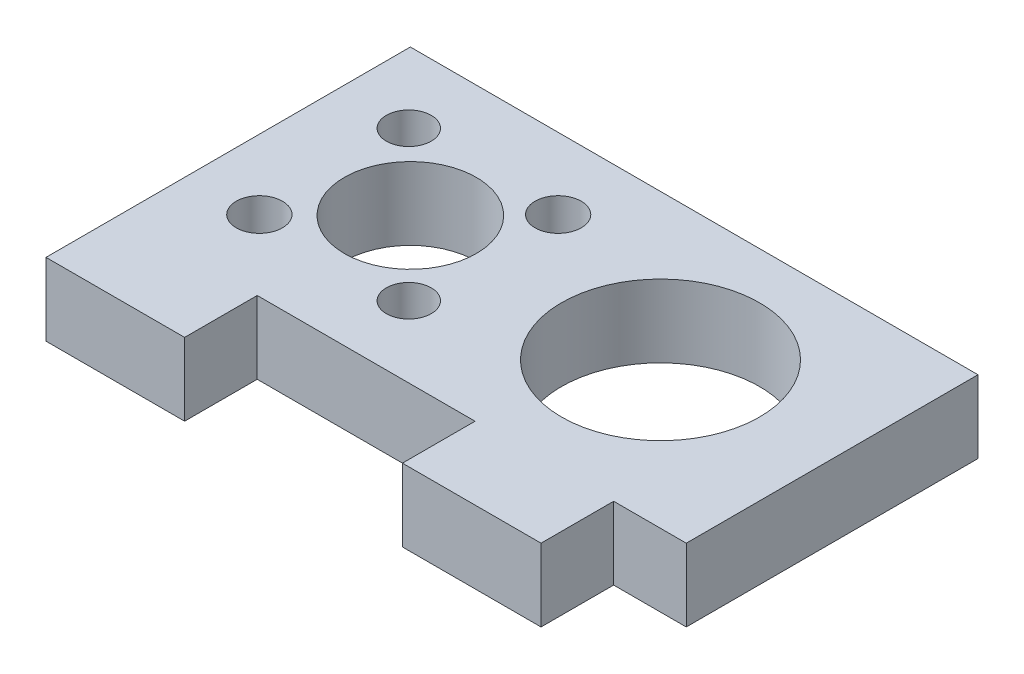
SolidWorks part; units mm, degrees
ref_plane "Front Plane" through (0, 0, 0) normal (0, 0, 1) x (1, 0, 0)
ref_plane "Top Plane" through (0, 0, 0) normal (0, 1, 0) x (1, 0, 0)
ref_plane "Right Plane" through (0, 0, 0) normal (1, 0, 0) x (0, 0, -1)
sketch "Sketch2" plane through (0, 0, 0) normal (0, 1, 0) x (1, 0, 0)
  line L0 (0, 0) -> (-37.3813, 0) construction
  line L1 (-37.3813, 0) -> (-37.3813, 5.5) construction
  line L2 (-37.3813, 5.5) -> (0, 5.5) construction
  line L4 (-37.3813, 5.5) -> (-37.3813, 27.6) construction
  line L5 (-37.3813, 27.6) -> (0.1187, 27.6) construction
  line L6 (0.1187, 27.6) -> (0.1187, 5.5) construction
  line L7 (0.1187, 5.5) -> (5.6187, 5.5) construction
  line L8 (5.6187, 5.5) -> (5.6187, 27.6) construction
  line L9 (5.6187, 27.6) -> (0.1187, 27.6) construction
  line L10 (-37.3813, 0) -> (-26.8813, 0) construction
  line L11 (0.1187, 27.6) -> (-14.8813, 27.6) construction
  line L12 (-37.3813, 27.6) -> (-15.2813, 27.6) construction
  line L13 (-15.2813, 27.6) -> (-15.2813, 5.5) construction
  line L14 (-14.8813, 27.6) -> (-14.8813, 5.5) construction
  line L15 (-14.8813, 16.55) -> (0.1187, 16.55) construction
  line L16 (-37.3813, 27.6) -> (-15.2813, 5.5) construction
  line L17 (-37.3813, 5.5) -> (-15.2813, 27.6) construction
  line L18 (-26.8813, 0) -> (-26.8813, 5.5) construction
  line L19 (0, 0) -> (-10.3813, 0) construction
  line L20 (-10.3813, 0) -> (-10.3813, 5.5) construction
  line L21 (-37.3813, 27.6) -> (0.1187, 27.6)
  line L22 (-37.3813, 27.6) -> (-37.3813, 0)
  line L23 (-37.3813, 0) -> (-26.8813, 0)
  line L24 (-26.8813, 0) -> (-26.8813, 5.5)
  line L25 (-26.8813, 5.5) -> (-10.3813, 5.5)
  line L26 (-10.3813, 5.5) -> (-10.3813, 0)
  line L27 (-10.3813, 0) -> (0, 0)
  line L29 (5.6187, 13.3165) -> (5.6187, 19.7835)
  line L31 (0.1187, 27.6) -> (5.6187, 27.6)
  line L32 (5.6187, 27.6) -> (5.6187, 19.7835)
  line L33 (5.6187, 13.3165) -> (5.6187, 5.5)
  line L34 (5.6187, 5.5) -> (0.1187, 5.5)
  line L37 (0.1187, 5.5) -> (0.1187, 0)
  line L38 (0.1187, 0) -> (0, 0)
  circle A1 centre (-7.3813, 16.55) radius 7.5
  circle A2 centre (-26.3313, 16.55) radius 5
  circle A4 centre (-32.1096, 22.2099) radius 1.7
  circle A5 centre (-20.7931, 22.2069) radius 1.75
  circle A6 centre (-32.1096, 10.8902) radius 1.75
  circle A7 centre (-20.7931, 10.8931) radius 1.7
  point P34 (-33.2864, 9.5949)
  point P36 (-19.4978, 23.3835)
  point P37 (-33.251, 23.4698)
  point P38 (-19.5332, 9.7519)
  dimension "D2" = 5.5
  dimension "D3" = 19.5
  dimension "D1" = 15.4
  dimension "D4" = 19.4
extrude "Boss-Extrude1" add sketch "Sketch2" along normal blind 5.5
